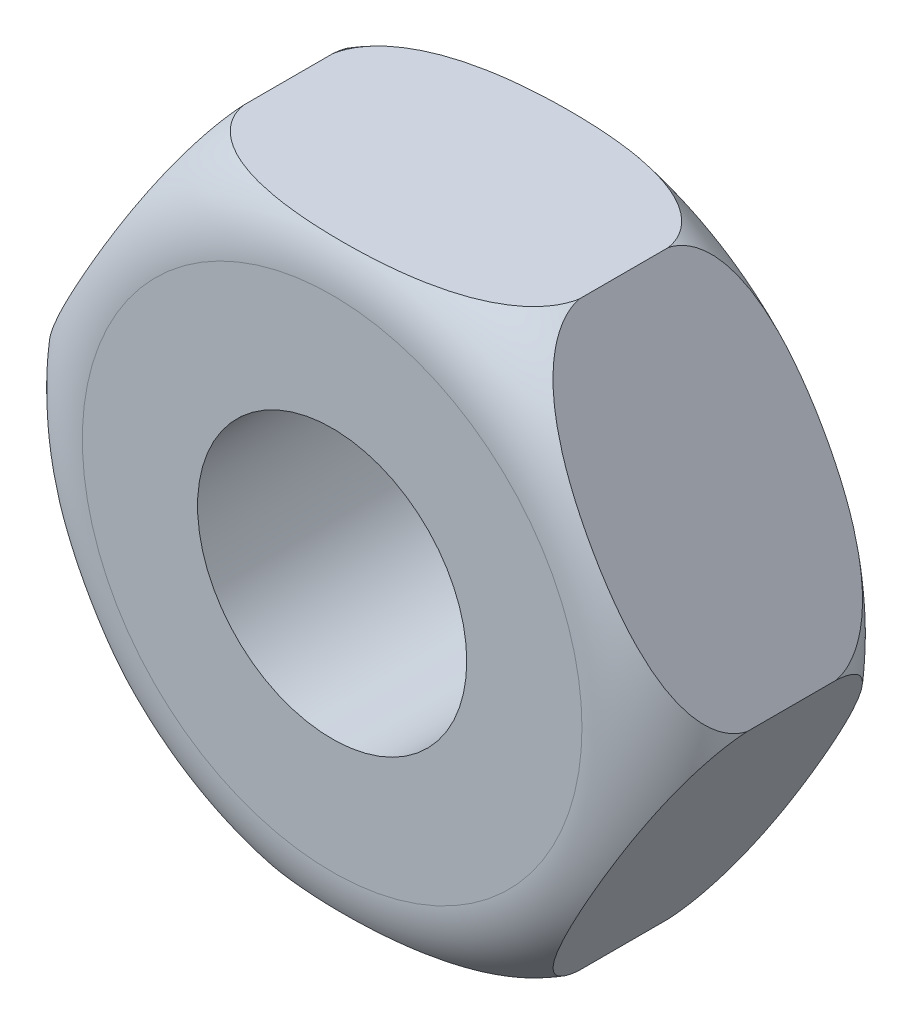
SolidWorks part; units mm, degrees
ref_plane "Plan de face" through (0, 0, 0) normal (0, 0, 1) x (1, 0, 0)
ref_plane "Plan de dessus" through (0, 0, 0) normal (0, 1, 0) x (1, 0, 0)
ref_plane "Plan de droite" through (0, 0, 0) normal (1, 0, 0) x (0, 0, -1)
sketch "Esquisse1" plane through (0, 0, 0) normal (0, 0, 1) x (1, 0, 0)
  circle A0 centre (0, 0) radius 3.12
  circle A1 centre (0, 0) radius 1.25
  dimension "D1" = 6.24
  dimension "D2" = 2.5
extrude "Extrusion1" add sketch "Esquisse1" along normal blind 2.3
fillet "Congé1" radius 0.8 2 edges at (3.12, 0, 0) (3.12, 0, 2.3)
sketch "Esquisse2" plane through (0, 0, 0) normal (0, 0, 1) x (1, 0, 0)
  line L1 (3.1177, 0) -> (1.5588, 2.7)
  line L2 (1.5588, 2.7) -> (-1.5588, 2.7)
  line L3 (-1.5588, 2.7) -> (-3.1177, 0)
  line L4 (-3.1177, 0) -> (-1.5588, -2.7)
  line L5 (-1.5588, -2.7) -> (1.5588, -2.7)
  line L6 (1.5588, -2.7) -> (3.1177, 0)
  circle A0 centre (0, 0) radius 2.7 construction
  dimension "D1" = 5.4
extrude "Enlèv. mat.-Extru.2" cut sketch "Esquisse2" along normal blind 6 flip side to cut
